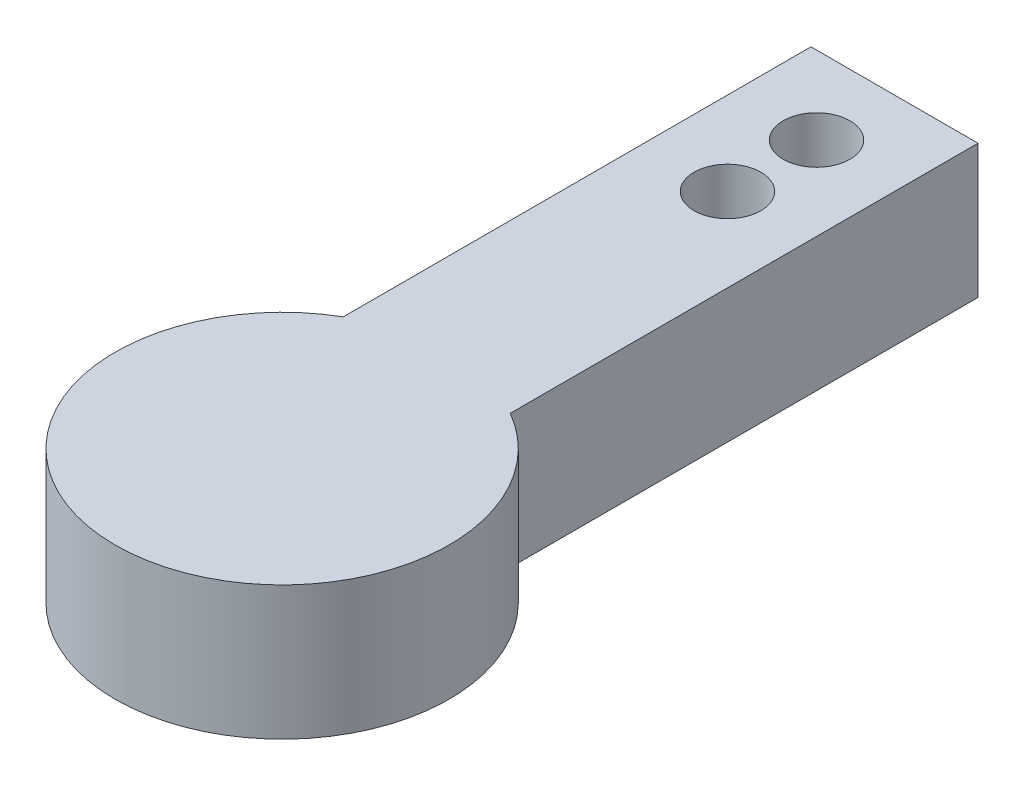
SolidWorks part; units mm, degrees
ref_plane "Front Plane" through (0, 0, 0) normal (0, 0, 1) x (1, 0, 0)
ref_plane "Top Plane" through (0, 0, 0) normal (0, 1, 0) x (1, 0, 0)
ref_plane "Right Plane" through (0, 0, 0) normal (1, 0, 0) x (0, 0, -1)
sketch "Sketch1" plane through (0, 0, 0) normal (0, 1, 0) x (1, 0, 0)
  line L0 (-3.75, 7.5) -> (-3.75, 6.4952)
  line L1 (-3.75, 27.5) -> (3.75, 27.5)
  line L2 (-3.75, 27.5) -> (-3.75, 7.5)
  line L3 (-3.75, 7.5) -> (3.75, 7.5)
  line L4 (3.75, 27.5) -> (3.75, 7.5)
  line L5 (-3.75, 27.5) -> (3.75, 7.5) construction
  line L6 (-3.75, 7.5) -> (3.75, 27.5) construction
  line L7 (3.75, 7.5) -> (3.75, 6.4952)
  circle A0 centre (0, 0) radius 7.5
  point P3 (0, 17.5)
  dimension "D1" = 15
  dimension "D2" = 20
  dimension "D3" = 7.5
extrude "Boss-Extrude1" add sketch "Sketch1" along normal blind 6 contours L4 L1 L2 L3 | A0 L7 L3 | A0 L3 L0 | A0
sketch "Sketch2" plane through (0, 0, 0) normal (0, -1, 0) x (1, 0, 0)
  circle A0 centre (0, 0) radius 3
  circle A1 centre (0, -20) radius 1.5
  circle A2 centre (0, -24) radius 1.5
  dimension "D1" = 6
  dimension "D2" = 3
  dimension "D3" = 3
  dimension "D4" = 4
  dimension "D5" = 20
extrude "Cut-Extrude1" cut sketch "Sketch2" against normal through all
sketch "Sketch3" plane through (0, 6, 0) normal (0, 1, 0) x (1, 0, 0)
  circle A0 centre (0, 0) radius 3
extrude "Boss-Extrude2" add sketch "Sketch3" against normal blind 1
